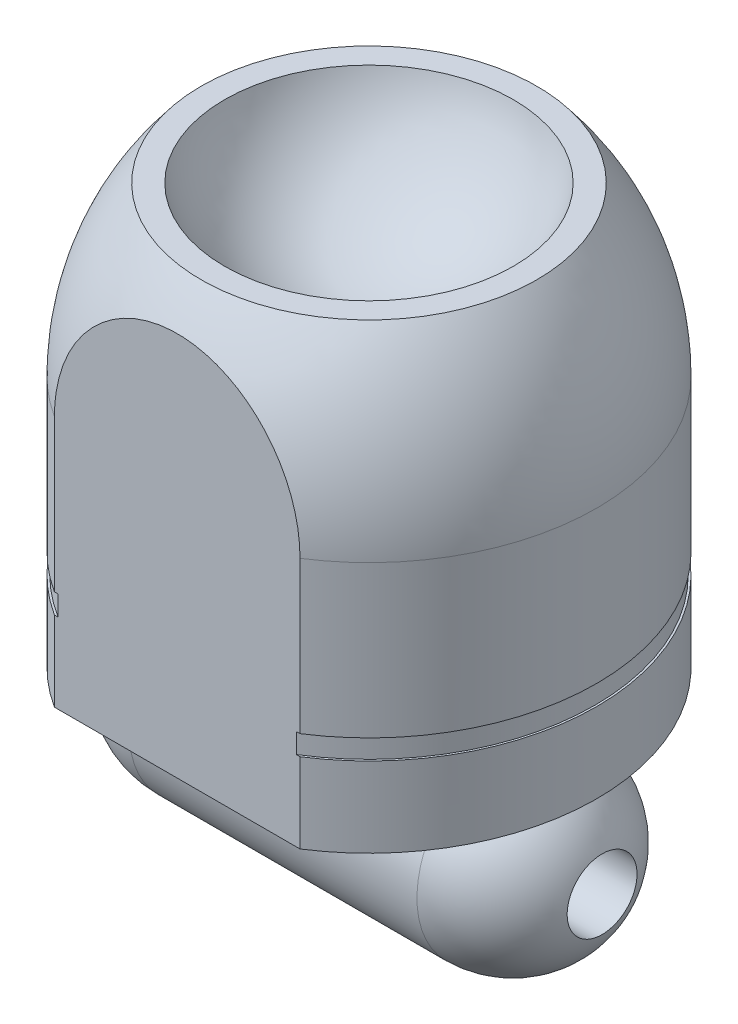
SolidWorks part; units mm, degrees
ref_plane "Plan de face" through (0, 0, 0) normal (0, 0, 1) x (1, 0, 0)
ref_plane "Plan de dessus" through (0, 0, 0) normal (0, 1, 0) x (1, 0, 0)
ref_plane "Plan de droite" through (0, 0, 0) normal (1, 0, 0) x (0, 0, -1)
sketch "Esquisse1" plane through (0, 0, 0) normal (0, 0, 1) x (1, 0, 0)
  line L0 (0, 210) -> (0, -67.1466) construction
  line L1 (0, 0) -> (-114, 0)
  line L2 (-114, 0) -> (-114, 40)
  line L3 (0, 210) -> (-84, 210)
  line L4 (0, 210) -> (0, 0)
  line L5 (-114, 50) -> (-114, 126)
  line L6 (-114, 50) -> (-113, 50)
  line L8 (-114, 40) -> (-113, 40)
  line L9 (-113, 50) -> (-113, 40)
  arc A0 (-84, 210) -> (-114, 126) centre (18.6, 126) ccw
  dimension "D1" = 210
  dimension "D2" = 228
  dimension "D3" = 168
  dimension "D4" = 126
  dimension "D5" = 10
  dimension "D6" = 40
  dimension "D7" = 1
revolve "Révolution1" add sketch "Esquisse1" angle 360 about L0
sketch "Esquisse2" plane through (0, 0, 0) normal (1, 0, 0) x (0, 0, -1)
  line L0 (-96, 234.0229) -> (-96, -20.0306)
  dimension "D1" = 96
extrude "Enlèv. mat.-Extru.1" cut sketch "Esquisse2" against normal through all and the other way through all flip side to cut
sketch "Esquisse3" plane through (0, 0, 0) normal (1, 0, 0) x (0, 0, -1)
  line L0 (114, 78) -> (78, 0)
  line L1 (-96, 0) -> (114, 0) construction
  line L3 (114, 50) -> (114, 126) construction
  dimension "D1" = 174
  dimension "D2" = 78
extrude "Enlèv. mat.-Extru.2" cut sketch "Esquisse3" against normal through all and the other way through all
sketch "Esquisse4" plane through (0, 0, 0) normal (0, 0, 1) x (1, 0, 0)
  line L0 (84, 210) -> (-84, 210) construction
  line L1 (0, 155) -> (0, 305)
  arc A0 (0, 305) -> (0, 155) centre (0, 230) ccw
  dimension "D1" = 150
  dimension "D2" = 20
revolve "Enlèvement de matière-Révolution1" cut sketch "Esquisse4" angle 360 about L1
sketch "Esquisse5" plane through (0, 0, 0) normal (0, 0, 1) x (1, 0, 0)
  line L0 (72, 33.1914) -> (72, -121.0873) construction
  line L1 (0, -18.9189) -> (0, 193.3428) construction
  line L2 (132.5787, -40) -> (-129.3308, -40) construction
  line L3 (72, 8) -> (-72, 8)
  line L5 (116.6962, -22.5) -> (-116.6962, -22.5)
  arc A0 (116.6962, -22.5) -> (72, 8) centre (72, -40) ccw
  arc A1 (-116.6962, -22.5) -> (-72, 8) centre (-72, -40) cw
  dimension "D1" = 96
  dimension "D2" = 72
  dimension "D3" = 40
  dimension "D4" = 35
revolve "Révolution2" add sketch "Esquisse5" angle 360 about L2
mirror "Symétrie1" about plane through (0, 0, 0) normal (1, 0, 0) of "Révolution2"
